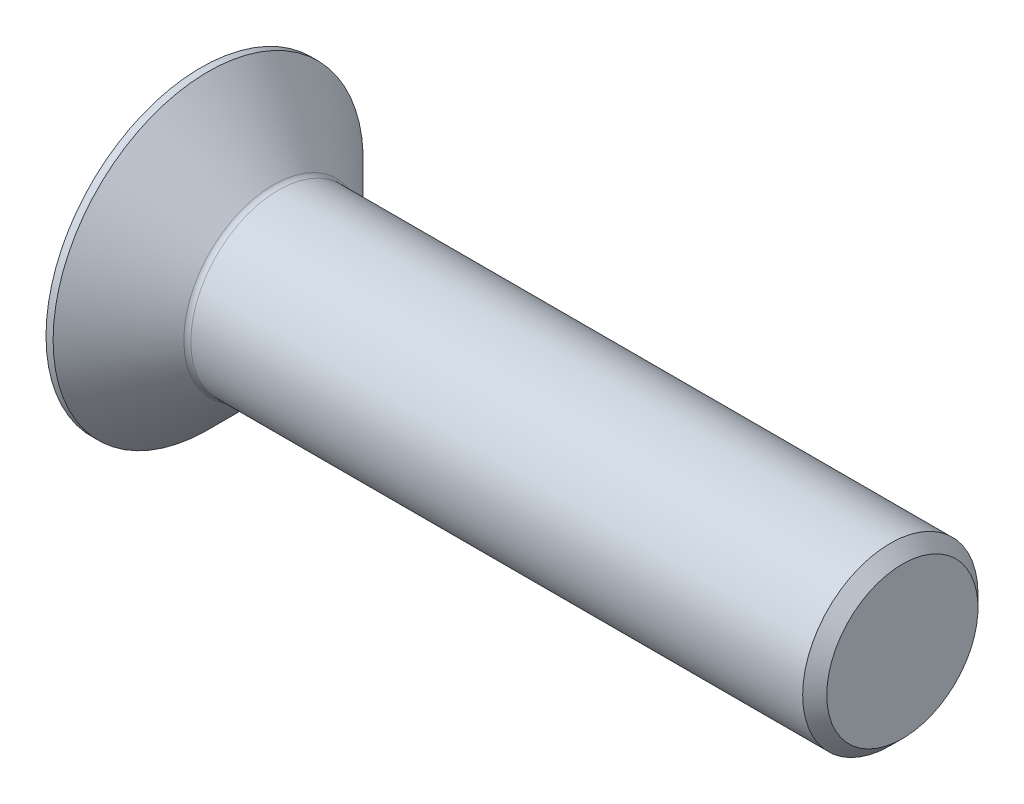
SolidWorks part; units mm, degrees
revolve "PreBroach" cut sketch "Sketch2"
sketch "Sketch2"
  line L0 (0, 6) -> (5.6, 6)
  line L1 (5.6, 6) -> (9.0641, 0)
  line L2 (0, 0) -> (127, 0) construction
  line L3 (9.0641, 0) -> (0, 0)
  line L4 (0, 0) -> (0, 6)
  line L5 (0, -6) -> (5.6, -6) construction
  line L6 (0, 0) -> (47.625, 0) construction
  line L8 (0, 17.69) -> (0, -17.69) construction
revolve "BaseBody" add sketch "BodySke" angle 360 about L6
sketch "BodySke" plane through (0, 0, 0) normal (0, 0, 1) x (1, 0, 0)
  line L0 (0, 0) -> (0, 17.69)
  line L1 (0.81, 17.69) -> (8.5, 10)
  line L2 (0, 17.69) -> (0.81, 17.69)
  line L3 (8.5, 10) -> (78.626, 10)
  line L4 (80, 8.626) -> (80, 0)
  line L5 (80, 0) -> (0, 0)
  line L6 (0, 0) -> (127, 0) construction
  line L7 (0.81, -17.69) -> (8.5, -10) construction
  line L8 (80, 8.626) -> (78.626, 10)
  line L9 (0, -17.69) -> (0.81, -17.69) construction
  line L10 (80, -8.626) -> (78.626, -10) construction
  line L11 (11, 16.35) -> (11, -5.875) construction
  line L12 (34, 16.35) -> (34, -5.875) construction
ref_plane "Plane1" through (0, 0, 0) normal (0, 0, 1) x (1, 0, 0)
ref_plane "Plane2" through (0, 0, 0) normal (0, 1, 0) x (1, 0, 0)
ref_plane "Plane3" through (0, 0, 0) normal (1, 0, 0) x (0, 0, -1)
other "Configuration Table"
fillet "Fillet1" radius 0.8 1 edges at (8.5, 0, 10)
sketch "Sketch3" plane through (0, 0, 0) normal (-1, 0, 0) x (0, 0, 1)
  line L0 (-6, -3.4641) -> (-6, 3.4641)
  line L1 (-6, 3.4641) -> (0, 6.9282)
  line L2 (0, 6.9282) -> (6, 3.4641)
  line L3 (6, 3.4641) -> (6, -3.4641)
  line L4 (6, -3.4641) -> (0, -6.9282)
  line L5 (0, -6.9282) -> (-6, -3.4641)
extrude "Hex" cut sketch "Sketch3" against normal blind 5.6
sketch "ThdSchSke" plane through (0, 0, 0) normal (0, 0, 1) x (1, 0, 0)
  line L0 (34, -8.626) -> (33.0379, -10)
  line L1 (34, -8.626) -> (34.9621, -10)
  line L2 (34.9621, -10) -> (34.9621, -12.5)
  line L3 (-3.175, 0) -> (5.1513, 0) construction
  line L4 (0, 17.69) -> (0, -17.69) construction
  line L5 (34.9621, -12.5) -> (33.0379, -12.5)
  line L6 (33.0379, -12.5) -> (33.0379, -10)
revolve "ThreadSchematic" [suppressed] cut sketch "ThdSchSke" angle 360 about L3
pattern_linear "ThdSchPat" [suppressed]
equation "\"Thread_minor@ThreadCosmetic\"  =  \"Minor_dia@BodySke\""
equation "\"D1@Sketch3\" = \"Hex_size@Sketch3\" / 2"
equation "\"D2@Sketch3\" = \"D1@Sketch3\""
equation "\"D3@Sketch3\" = \"Hex_size@Sketch3\""
equation "\"Thread_length@ThreadCosmetic\" = ((sgn( (\"Length@BodySke\" - \"Advance@BodySke\" * 1.5 - \"Head_ht@BodySke\" ) - \"Thread_nom@BodySke\" )-1)*( (\"Length@BodySke\" - \"Advance@BodySke\" * 1.5 - \"Head_ht@BodySke\" "
equation "\"Thread_minor@ThdSchSke\" = \"Minor_dia@BodySke\""
equation "\"Diameter@ThdSchSke\" = \"Diameter@BodySke\""
equation "\"Overcut@ThdSchSke\" = \"Diameter@BodySke\" * 1.25"
equation "\"Start@ThdSchSke\" = 0.000001 + \"Length@BodySke\" - \"Thread_length@ThreadCosmetic\"  '---Countersunk---"
equation "\"Num_threads@ThdSchPat\" = int( \"Thread_length@ThreadCosmetic\" / \"Advance@BodySke\" + 0.999 )  + 1"
equation "\"Advance@ThdSchPat\" = \"Thread_length@ThreadCosmetic\" /  (\"Num_threads@ThdSchPat\" - 1) 'relax it"
equation "\"Num_threads@ThdSchPat\" = \"Num_threads@ThdSchPat\" - sgn( \"Num_threads@ThdSchPat\" - 1) '---chamfered tips only---"
